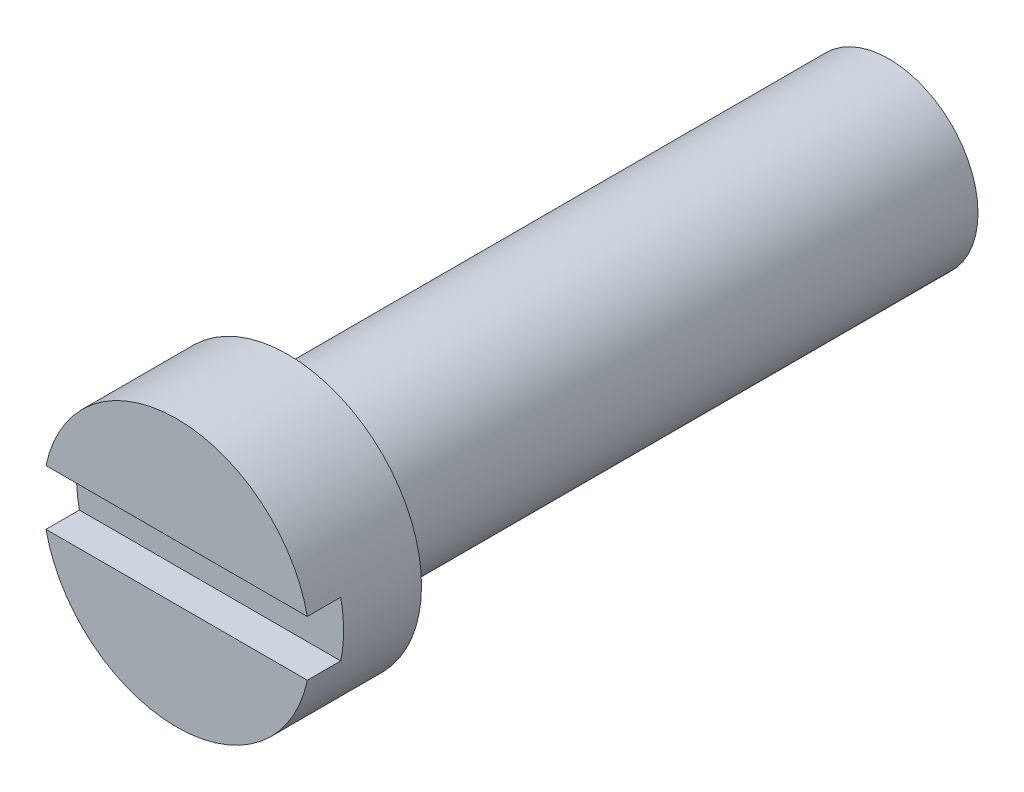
SolidWorks part; units mm, degrees
ref_plane "Front" through (0, 0, 0) normal (0, 0, 1) x (1, 0, 0)
ref_plane "Top" through (0, 0, 0) normal (0, 1, 0) x (1, 0, 0)
ref_plane "Right" through (0, 0, 0) normal (1, 0, 0) x (0, 0, -1)
sketch "Sketch1" plane through (0, 0, 0) normal (0, 0, 1) x (1, 0, 0)
  circle A1 centre (35, 0) radius 4
extrude "Extrude1" add sketch "Sketch1" against normal blind 27
sketch "Sketch2" plane through (0, 0, 0) normal (0, 0, 1) x (1, 0, 0)
  circle A2 centre (35, 0) radius 6
extrude "Extrude2" add sketch "Sketch2" along normal blind 5
sketch "Sketch3" plane through (0, 0, 5) normal (0, 0, 1) x (1, 0, 0)
  line L1 (29, 0) -> (41, 0) construction
  line L4 (29.1295, 1.2398) -> (40.8705, 1.2398)
  line L5 (29.1295, -1.2398) -> (40.8705, -1.2398)
  circle A2 centre (35, 0) radius 6 construction
  arc A3 (29.1295, 1.2398) -> (29.1295, -1.2398) centre (35, 0) ccw
  arc A4 (40.8705, 1.2398) -> (40.8705, -1.2398) centre (35, 0) cw
extrude "Cut-Extrude1" cut sketch "Sketch3" against normal blind 1.5
